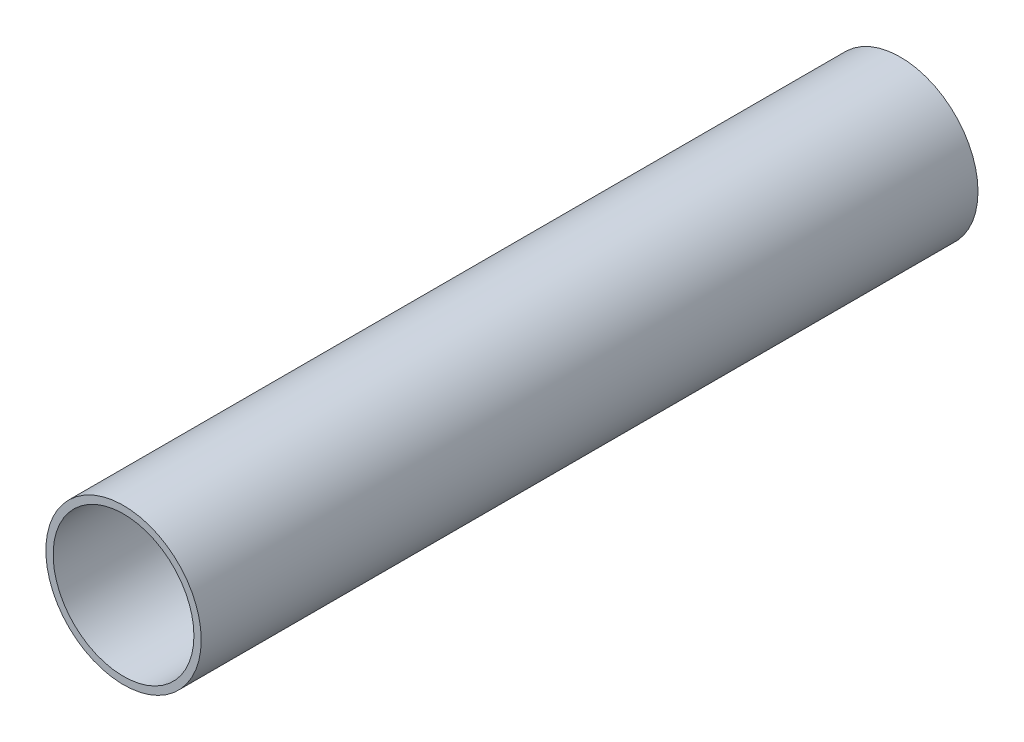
SolidWorks part; units mm, degrees
ref_plane "Front Plane" through (0, 0, 0) normal (0, 0, 1) x (1, 0, 0)
ref_plane "Top Plane" through (0, 0, 0) normal (0, 1, 0) x (1, 0, 0)
ref_plane "Right Plane" through (0, 0, 0) normal (1, 0, 0) x (0, 0, -1)
sketch "Sketch1" plane through (0, 0, 0) normal (0, 0, 1) x (1, 0, 0)
  circle A0 centre (0, 0) radius 8
  dimension "D1" = 16
extrude "Extrude1" add sketch "Sketch1" against normal blind 80
sketch "Sketch2" plane through (0, 0, 0) normal (0, 0, 1) x (1, 0, 0)
  circle A0 centre (0, 0) radius 7.25
  dimension "D1" = 14.5
extrude "Cut-Extrude1" cut sketch "Sketch2" against normal through all
